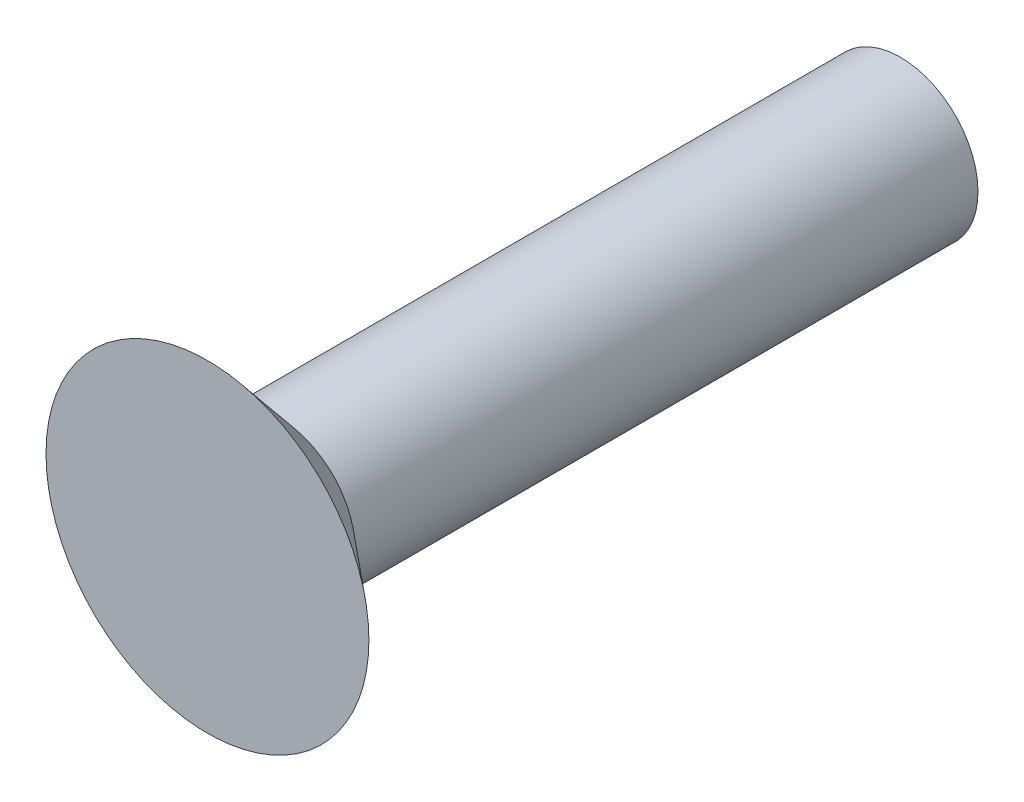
SolidWorks part; units mm, degrees
ref_plane "Front Plane" through (0, 0, 0) normal (0, 0, 1) x (1, 0, 0)
ref_plane "Top Plane" through (0, 0, 0) normal (0, 1, 0) x (1, 0, 0)
ref_plane "Right Plane" through (0, 0, 0) normal (1, 0, 0) x (0, 0, -1)
sketch "Sketch1" plane through (0, 0, 0) normal (0, 0, 1) x (1, 0, 0)
  circle A0 centre (0, 0) radius 0.7112
  dimension "D1" = 1.4224
extrude "Boss-Extrude1" add sketch "Sketch1" against normal blind 6.35
sketch "Sketch2" plane through (0, 0, 0) normal (0, 1, 0) x (1, 0, 0)
  line L0 (0, 0) -> (-1.4796, 0)
  line L1 (-1.4796, 0) -> (0, 1.2415)
  line L2 (0, 1.2415) -> (0, 0)
  dimension "D1" = 1.4796
  dimension "D2" = 50
revolve "Revolve1" add sketch "Sketch2" angle 360 about L2
